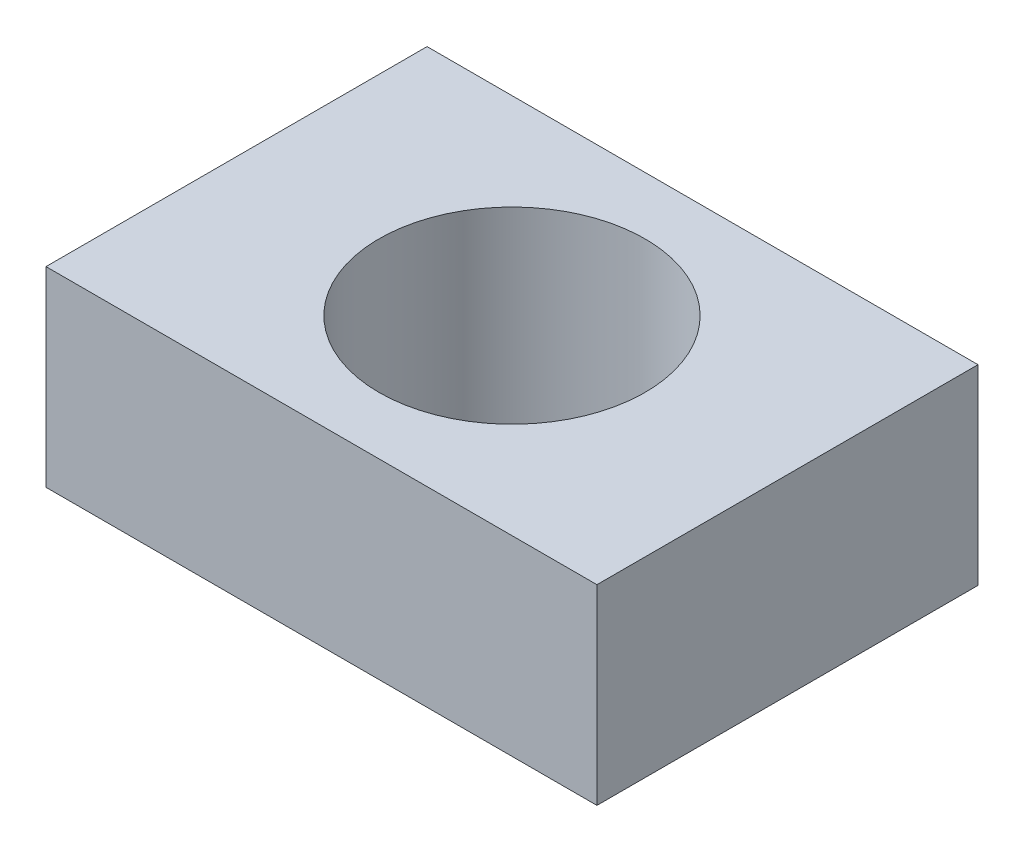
SolidWorks part; units mm, degrees
ref_plane "Front" through (0, 0, 0) normal (0, 0, 1) x (1, 0, 0)
ref_plane "Top" through (0, 0, 0) normal (0, 1, 0) x (1, 0, 0)
ref_plane "Right" through (0, 0, 0) normal (1, 0, 0) x (0, 0, -1)
sketch "Sketch1" plane through (0, 0, 0) normal (0, 1, 0) x (1, 0, 0)
  line L1 (-83.5746, 57.8054) -> (83.5746, 57.8054)
  line L2 (-83.5746, 57.8054) -> (-83.5746, -57.8054)
  line L3 (-83.5746, -57.8054) -> (83.5746, -57.8054)
  line L4 (83.5746, 57.8054) -> (83.5746, -57.8054)
  line L5 (-83.5746, 57.8054) -> (83.5746, -57.8054) construction
  line L6 (-83.5746, -57.8054) -> (83.5746, 57.8054) construction
  circle A0 centre (0, 0) radius 40.3658
  point P0 (0, 0)
extrude "Boss-Extrude1" add sketch "Sketch1" along normal blind 58
